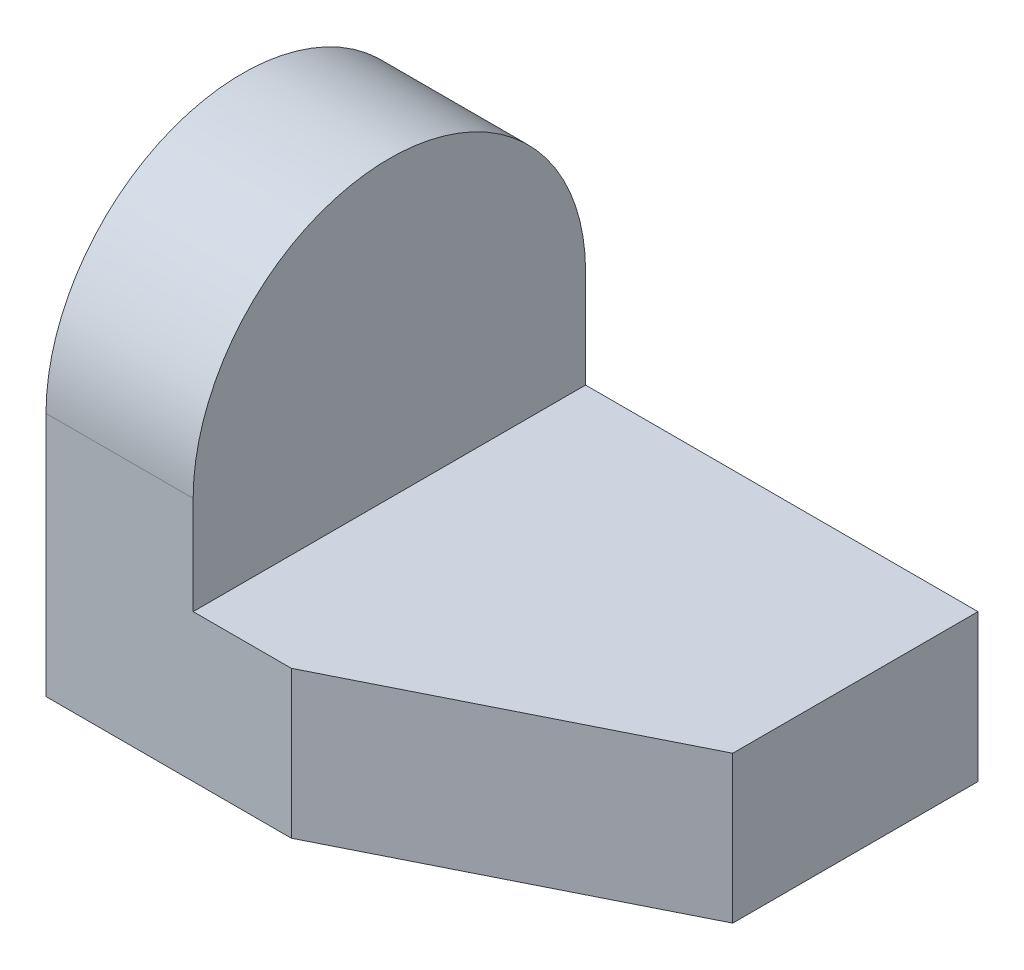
SolidWorks part; units mm, degrees
extrude "Base-Extrude-Thin" add sketch "Sketch1" along normal blind 80 thin
sketch "Sketch1" plane through (0, 0, 0) normal (0, 0, 1) x (1, 0, 0)
  line L0 (0, 90) -> (0, 0)
  line L1 (0, 0) -> (110, 0)
  dimension "D1" = 110
  dimension "D2" = 90
chamfer "Chamfer1" distance 60 distance2 30 1 edges at (110, 15, 80)
extrude "Cut-Extrude1" cut sketch "Sketch2" against normal through all and the other way through all
sketch "Sketch2" plane through (30, 0, 0) normal (1, 0, 0) x (0, 0, -1)
  line L0 (-80, 90) -> (-80, 30) construction
  line L1 (0, 90) -> (0, 30) construction
  line L2 (-80, 90) -> (0, 90) construction
  arc A0 (-80, 50) -> (0, 50) centre (-40, 50) cw
ref_plane "Front" through (0, 0, 0) normal (0, 0, 1) x (1, 0, 0)
ref_plane "Top" through (0, 0, 0) normal (0, 1, 0) x (1, 0, 0)
ref_plane "Right" through (0, 0, 0) normal (1, 0, 0) x (0, 0, -1)
